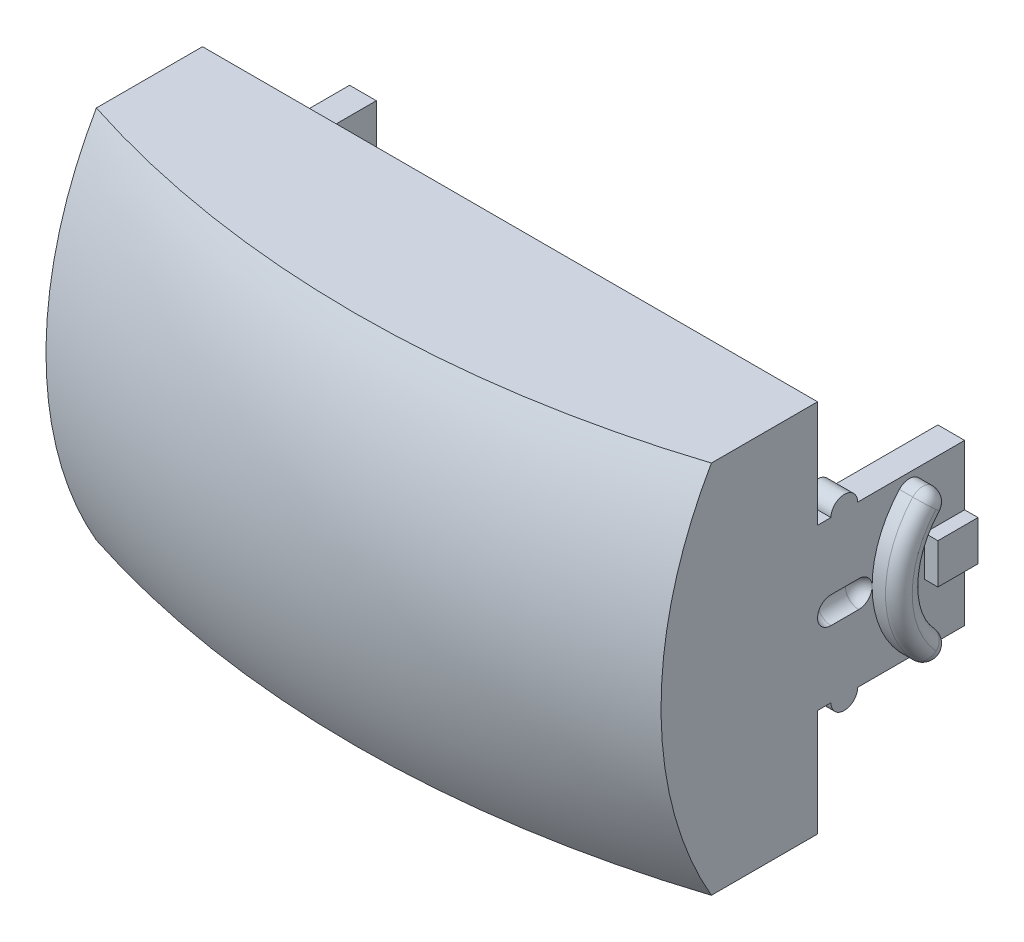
SolidWorks part; units mm, degrees
ref_plane "Plan de face" through (0, 0, 0) normal (0, 0, 1) x (1, 0, 0)
ref_plane "Plan de dessus" through (0, 0, 0) normal (0, 1, 0) x (1, 0, 0)
ref_plane "Plan de droite" through (0, 0, 0) normal (1, 0, 0) x (0, 0, -1)
sketch "Esquisse1" plane through (0, 0, 0) normal (0, 0, 1) x (1, 0, 0)
  line L1 (-11.5, 7) -> (11.5, 7)
  line L2 (-11.5, 7) -> (-11.5, -7)
  line L3 (-11.5, -7) -> (11.5, -7)
  line L4 (11.5, 7) -> (11.5, -7)
  dimension "D1" = 23
  dimension "D2" = 11.5
  dimension "D3" = 14
  dimension "D4" = 7
extrude "Extrusion1" add sketch "Esquisse1" along normal mid plane 30
sketch "Esquisse2" plane through (0, 0, 0) normal (1, 0, 0) x (0, 0, -1)
  line L0 (29.0202, 12.1511) -> (29.0202, -10.2166) construction
  line L3 (-10.1898, 0) -> (33.5453, 0) construction
  line L4 (-15, 7) -> (15, 7) construction
  line L5 (-15, -7) -> (15, -7) construction
  line L6 (-8.3925, 7) -> (-22.8219, 7)
  line L7 (-22.8219, 7) -> (-22.8219, -7)
  line L8 (-22.8219, -7) -> (-8.3925, -7)
  arc A0 (-8.3925, 7) -> (-8.3925, -7) centre (4.3402, 0) ccw
  dimension "D1" = 14.53
  dimension "D2" = 39.21
revolve "Enlèvement de matière-Révolution1" cut sketch "Esquisse2" angle 180 about L0
shell "Coque1" thickness 1
sketch "Esquisse3" plane through (11.5, 0, 0) normal (1, 0, 0) x (0, 0, -1)
  line L0 (-2.6112, 8.6274) -> (-2.6112, -8.6865) construction
  line L1 (2.8888, 8.6274) -> (2.8888, -8.6865) construction
  line L2 (-11.777, 3) -> (16.8235, 3) construction
  line L3 (-6.5812, 7) -> (15, 7) construction
  line L4 (-11.777, -3) -> (16.8235, -3) construction
  line L5 (-6.5812, -7) -> (15, -7) construction
  line L6 (-2.6112, 7.0319) -> (-2.6112, 3)
  line L7 (-2.6112, 3) -> (-2.1112, 3)
  line L8 (-2.1112, -8.6865) -> (-2.1112, 8.6274) construction
  line L9 (-1.1112, 3) -> (2.8888, 3)
  line L10 (2.8888, 3) -> (2.8888, -3)
  line L11 (15, 0) -> (-10.1898, 0) construction
  line L12 (15, -7) -> (15, 7) construction
  line L13 (-1.1112, -3) -> (2.8888, -3)
  line L14 (-2.6112, -3) -> (-2.1112, -3)
  line L15 (-2.6112, -7.0319) -> (-2.6112, -3)
  line L16 (-2.6112, 7.0319) -> (15, 7)
  line L17 (15, 7) -> (15, -7)
  line L18 (15, -7) -> (-2.6112, -7.0319)
  arc A0 (-2.1112, 3) -> (-1.1112, 3) centre (-1.6112, 3) cw
  arc A1 (-8.3925, 7) -> (-8.3925, -7) centre (4.3402, 0) ccw construction
  arc A2 (-2.1112, -3) -> (-1.1112, -3) centre (-1.6112, -3) ccw
  dimension "D7" = 0.5
  dimension "D1" = 3.97
  dimension "D2" = 5.5
  dimension "D3" = 4
  dimension "D4" = 4
  dimension "D5" = 0.5
  dimension "D6" = 0.5
extrude "Enlèv. mat.-Extru.2" cut sketch "Esquisse3" against normal blind 30
sketch "Esquisse4" plane through (11.5, 0, 0) normal (1, 0, 0) x (0, 0, -1)
  line L0 (3.3288, 5.1914) -> (3.3288, -4.9941) construction
  line L1 (-2.6112, 7) -> (-2.6112, 3) construction
  line L2 (-8.4654, 0.0323) -> (3.3288, 0) construction
  arc A0 (0.4498, 2.6308) -> (0.4498, -2.6308) centre (3.3288, 0) ccw
  arc A1 (1.188, 1.9563) -> (1.188, -1.9563) centre (3.3288, 0) ccw
  arc A2 (1.188, 1.9563) -> (0.4498, 2.6308) centre (0.8189, 2.2935) ccw
  arc A3 (1.188, -1.9563) -> (0.4498, -2.6308) centre (0.8189, -2.2935) cw
  point P6 (-6.5812, 7)
  point P7 (-6.5812, -7)
  point P8 (1.499, 2.2498)
  point P10 (-1.1904, 3.6756)
  point P18 (1.499, -2.2498)
  point P21 (3.3288, -1.8717)
  dimension "D2" = 7.8
  dimension "D3" = 1
  dimension "D4" = 0.5
  dimension "D1" = 5.94
extrude "Extrusion2" add sketch "Esquisse4" along normal blind 1
fillet "Congé1" radius 0.5 4 edges at (12.5, 0, -0.4288) (12.5, -2.6626, -1.1562) (12.5, 0, 0.5712) (12.5, 2.6626, -1.1562)
sketch "Esquisse5" plane through (11.5, 0, 0) normal (1, 0, 0) x (0, 0, -1)
  line L0 (2.8888, 0) -> (-2.7322, 0) construction
  line L1 (2.8888, 3) -> (2.8888, -3) construction
  line L3 (2.8888, 0.75) -> (1.3888, 0.75)
  line L4 (2.8888, 0.75) -> (2.8888, -0.75)
  line L5 (2.8888, -0.75) -> (1.3888, -0.75)
  line L6 (1.3888, 0.75) -> (1.3888, -0.75)
  dimension "D1" = 1.5
  dimension "D2" = 1.5
  dimension "D3" = 0.75
extrude "Extrusion3" add sketch "Esquisse5" along normal blind 0.5
sketch "Esquisse6" plane through (11.5, 0, 0) normal (1, 0, 0) x (0, 0, -1)
  line L0 (-8.4655, 0) -> (-0.5712, 0) construction
  line L1 (-2.6112, 3) -> (-2.6112, -3) construction
  line L2 (-2.1112, 0.5) -> (-1.0712, 0.5)
  line L4 (-2.1112, -0.5) -> (-1.0712, -0.5)
  arc A1 (-2.1112, 0.5) -> (-2.1112, -0.5) centre (-2.1112, 0) ccw
  arc A2 (-1.0712, 0.5) -> (-1.0712, -0.5) centre (-1.0712, 0) cw
  arc A3 (0.4498, 2.6308) -> (0.4498, -2.6308) centre (3.3288, 0) ccw construction
  point P2 (-6.5812, 7)
  point P3 (-6.5812, -7)
  point P13 (-3.5712, 0.75)
  point P16 (-0.5712, 0.75)
  dimension "D4" = 0.5
  dimension "D1" = 1.04
  dimension "D2" = 0.5
  dimension "D3" = 0.5
extrude "Enlèv. mat.-Extru.3" cut sketch "Esquisse6" against normal blind 0.5
fillet "Congé2" radius 0.5 4 edges at (11, 0.5, 1.5912) (11, 0, 0.5712) (11, -0.5, 1.5912) (11, 0, 2.6112)
mirror "Symétrie2" about plane through (0, 0, 0) normal (1, 0, 0) of "Congé2", "Congé1", "Extrusion2", "Extrusion3", "Enlèv. mat.-Extru.3"
